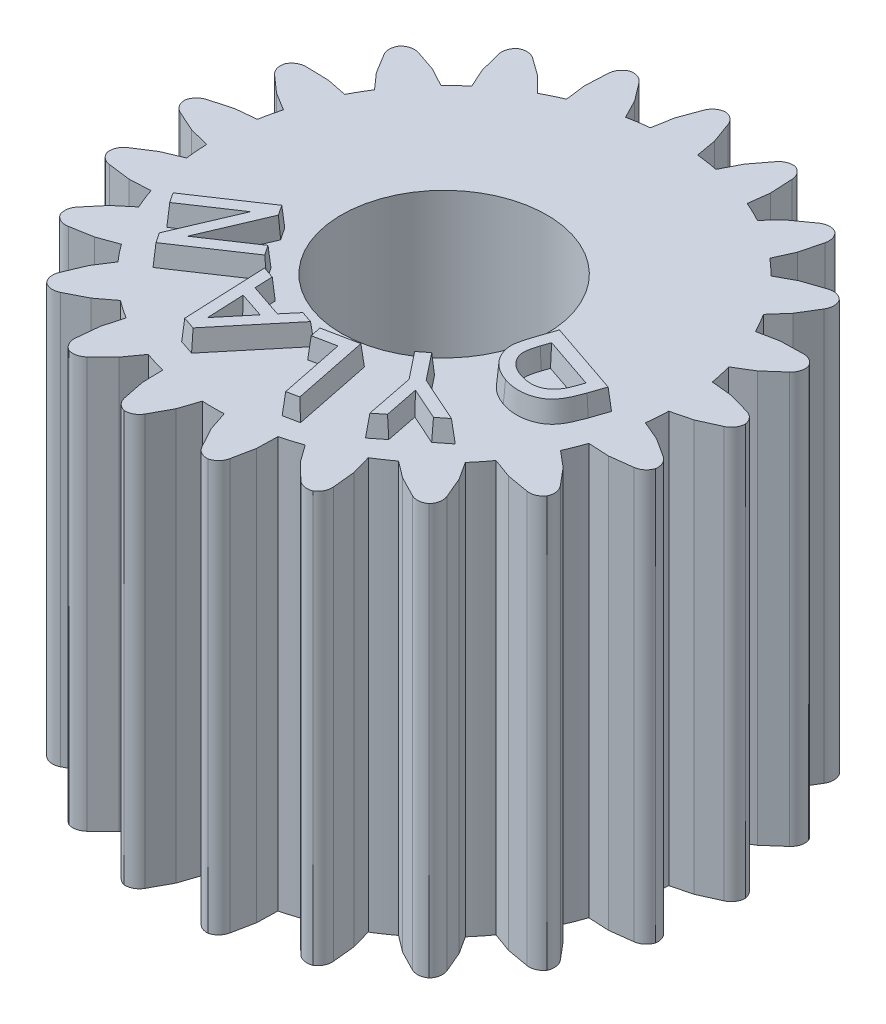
SolidWorks part; units mm, degrees
ref_plane "Front Plane" through (0, 0, 0) normal (0, 0, 1) x (1, 0, 0)
ref_plane "Top Plane" through (0, 0, 0) normal (0, 1, 0) x (1, 0, 0)
ref_plane "Right Plane" through (0, 0, 0) normal (1, 0, 0) x (0, 0, -1)
sketch "Sketch1" plane through (0, 0, 0) normal (0, 1, 0) x (1, 0, 0)
  circle A0 centre (0, 0) radius 28.575
  dimension "D1" = 57.15
extrude "Boss-Extrude1" add sketch "Sketch1" along normal blind 50.8
sketch "Sketch2" plane through (0, 50.8, 0) normal (0, 1, 0) x (1, 0, 0)
  line L0 (-2.921, 28.4253) -> (2.921, 28.4253)
  line L1 (2.921, 28.4253) -> (2.4731, 30.9653)
  line L2 (2.4731, 30.9653) -> (1.0864, 34.7753)
  line L3 (1.0864, 34.7753) -> (-1.0864, 34.7753)
  line L4 (-1.0864, 34.7753) -> (-2.4731, 30.9653)
  line L5 (-2.4731, 30.9653) -> (-2.921, 28.4253)
  circle A0 centre (0, 0) radius 28.575 construction
  dimension "D1" = 2.54
  dimension "D2" = 3.81
  dimension "D3" = 5.842
  dimension "D4" = 80
  dimension "D5" = 110
extrude "Boss-Extrude2" add sketch "Sketch2" against normal blind 50.8
fillet "Fillet1" radius 1.778 2 edges at (1.0864, 25.4, -34.7753) (-1.0864, 25.4, -34.7753)
pattern_circular "CirPattern1" count 21 over 360 about axis through (0, 0, 0) along (0, 1, 0) of "Fillet1", "Boss-Extrude2"
sketch "Sketch3" plane through (0, 50.8, 0) normal (0, 1, 0) x (1, 0, 0)
  circle A0 centre (0, 0) radius 12.7
  dimension "D1" = 25.4
extrude "Cut-Extrude1" cut sketch "Sketch3" against normal up to vertex
sketch "Sketch4" plane through (0, 50.8, 0) normal (0, 1, 0) x (1, 0, 0)
  circle A0 centre (0, 0) radius 15.875 construction
  circle A1 centre (0, 0) radius 12.7 construction
  arc A2 (-9.7016, -26.8777) -> (-7.1249, -27.6725) centre (0, 0) ccw construction
  text T0 "<b>DYLAN</b>" font "Century Gothic" height 10.16
  dimension "D1" = 12.7
  dimension "D2" = 3.175
extrude "Boss-Extrude3" add sketch "Sketch4" along normal blind 2.54 draft 5
